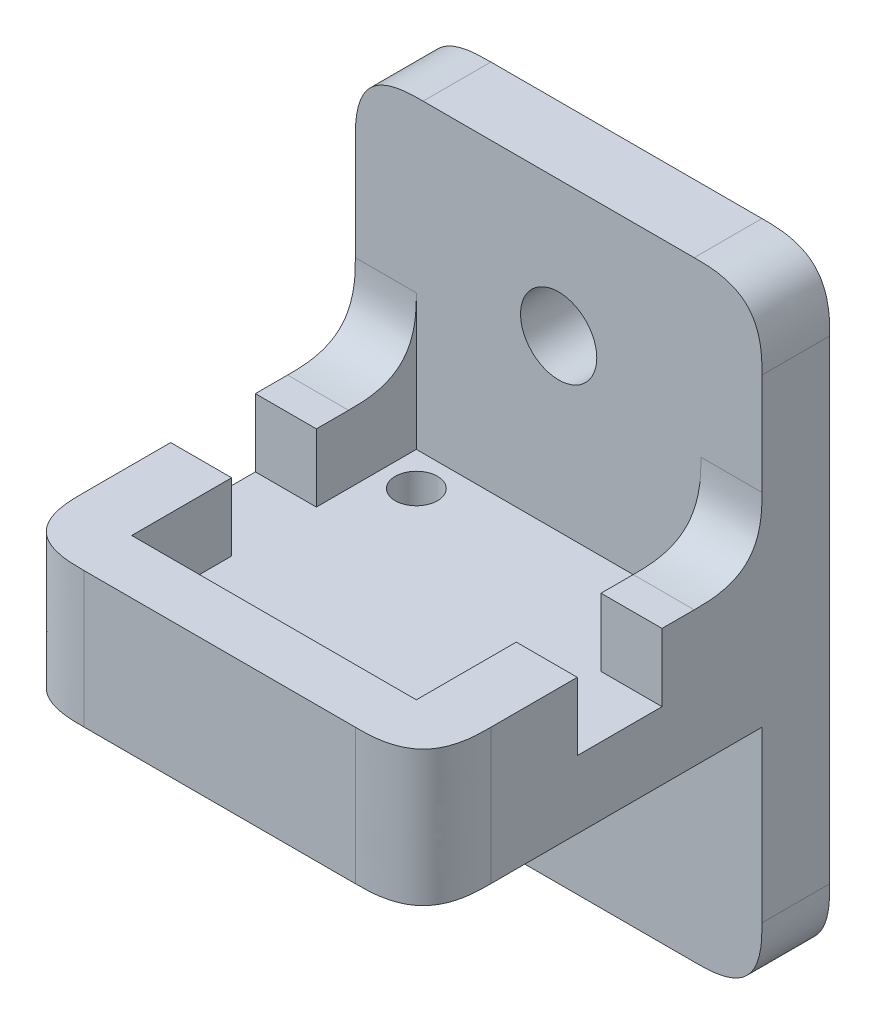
SolidWorks part; units mm, degrees
ref_plane "Front Plane" through (0, 0, 0) normal (0, 0, 1) x (1, 0, 0)
ref_plane "Top Plane" through (0, 0, 0) normal (0, 1, 0) x (1, 0, 0)
ref_plane "Right Plane" through (0, 0, 0) normal (1, 0, 0) x (0, 0, -1)
sketch "Sketch1" plane through (0, 0, 0) normal (0, 0, 1) x (1, 0, 0)
  line L1 (-19.05, -28.575) -> (19.05, -28.575)
  line L2 (-19.05, -28.575) -> (-19.05, 28.575)
  line L3 (-19.05, 28.575) -> (19.05, 28.575)
  line L4 (19.05, -28.575) -> (19.05, 28.575)
  line L5 (-19.05, -28.575) -> (19.05, 28.575) construction
  line L6 (-19.05, 28.575) -> (19.05, -28.575) construction
  circle A0 centre (0, 15.875) radius 3.5719
  circle A1 centre (0, -15.875) radius 3.5719
  point P0 (0, 0)
  dimension "D3" = 7.1437
  dimension "D4" = 12.7
  dimension "D5" = 31.75
  dimension "D6" = 7.1437
  dimension "D1" = 38.1
  dimension "D2" = 12.7
extrude "Boss-Extrude1" add sketch "Sketch1" along normal blind 6.35
sketch "Sketch2" plane through (0, 0, 6.35) normal (0, 0, 1) x (1, 0, 0)
  line L0 (19.05, -28.575) -> (19.05, 28.575) construction
  line L1 (-19.05, -6.35) -> (19.05, -6.35)
  line L2 (-19.05, -6.35) -> (-19.05, 6.35)
  line L3 (-19.05, 6.35) -> (19.05, 6.35)
  line L4 (19.05, -6.35) -> (19.05, 6.35)
  line L5 (-19.05, -6.35) -> (19.05, 6.35) construction
  line L6 (-19.05, 6.35) -> (19.05, -6.35) construction
  point P0 (0, 0)
  dimension "D1" = 12.7
extrude "Boss-Extrude2" add sketch "Sketch2" along normal blind 31.75
sketch "Sketch3" plane through (0, 6.35, 0) normal (0, 1, 0) x (1, 0, 0)
  line L1 (-13.335, -33.02) -> (13.335, -33.02)
  line L2 (-13.335, -33.02) -> (-13.335, -6.35)
  line L3 (-13.335, -6.35) -> (13.335, -6.35)
  line L4 (13.335, -33.02) -> (13.335, -6.35)
  line L5 (-13.335, -33.02) -> (13.335, -6.35) construction
  line L6 (-13.335, -6.35) -> (13.335, -33.02) construction
  line L8 (19.05, -6.35) -> (-19.05, -6.35) construction
  line L9 (19.05, -6.35) -> (-19.05, -6.35)
  point P0 (0, -19.685)
  point P8 (0, -6.35)
  dimension "D1" = 26.67
  dimension "D2" = 26.67
extrude "Cut-Extrude1" cut sketch "Sketch3" against normal blind 6.35 contours L1 L4 L2 M6
sketch "Sketch4" plane through (13.335, 0, 0) normal (-1, 0, 0) x (0, 0, 1)
  line L0 (33.02, 0) -> (6.35, 0) construction
  line L1 (15.7163, 0) -> (23.6538, 0)
  line L2 (15.7163, 0) -> (15.7163, 6.35)
  line L3 (15.7163, 6.35) -> (23.6538, 6.35)
  line L4 (23.6538, 0) -> (23.6538, 6.35)
  line L5 (33.02, 0) -> (6.35, 0)
  line L6 (38.1, 6.35) -> (6.35, 6.35) construction
  point P6 (19.685, 0)
  point P7 (19.685, 6.35)
  dimension "D2" = 7.9375
extrude "Cut-Extrude2" cut sketch "Sketch4" against normal through all both and the other way through all contours L4 L3 L2 M7
sketch "Sketch5" plane through (0, 0, 0) normal (0, 1, 0) x (1, 0, 0)
  line L0 (12.7, -32.385) -> (12.7, -23.0188) construction
  line L1 (12.7, -23.0188) -> (18.415, -23.0188) construction
  line L2 (18.415, -23.0188) -> (18.415, -16.3513) construction
  line L3 (18.415, -16.3513) -> (12.7, -16.3513) construction
  line L4 (12.7, -16.3513) -> (12.7, -6.985) construction
  line L5 (12.7, -6.985) -> (-12.7, -6.985) construction
  line L6 (-12.7, -6.985) -> (-12.7, -16.3513) construction
  line L7 (-12.7, -16.3513) -> (-18.415, -16.3513) construction
  line L8 (-18.415, -16.3513) -> (-18.415, -23.0188) construction
  line L9 (-18.415, -23.0188) -> (-12.7, -23.0188) construction
  line L10 (-12.7, -23.0188) -> (-12.7, -32.385) construction
  line L11 (-12.7, -32.385) -> (12.7, -32.385) construction
  line L12 (13.335, -33.02) -> (13.335, -23.6538)
  line L13 (13.335, -23.6538) -> (19.05, -23.6538)
  line L14 (19.05, -23.6538) -> (19.05, -15.7163)
  line L15 (19.05, -15.7163) -> (13.335, -15.7163)
  line L16 (13.335, -15.7163) -> (13.335, -6.35)
  line L17 (13.335, -6.35) -> (-13.335, -6.35)
  line L18 (-13.335, -6.35) -> (-13.335, -15.7163)
  line L19 (-13.335, -15.7163) -> (-19.05, -15.7163)
  line L20 (-19.05, -15.7163) -> (-19.05, -23.6538)
  line L21 (-19.05, -23.6538) -> (-13.335, -23.6538)
  line L22 (-13.335, -23.6538) -> (-13.335, -33.02)
  line L23 (-13.335, -33.02) -> (13.335, -33.02)
  line L24 (13.335, -33.02) -> (13.335, -23.6538) construction
  line L25 (13.335, -23.6538) -> (19.05, -23.6538) construction
  line L26 (19.05, -23.6538) -> (19.05, -15.7163) construction
  line L27 (19.05, -15.7163) -> (13.335, -15.7163) construction
  line L28 (13.335, -15.7163) -> (13.335, -6.35) construction
  line L29 (13.335, -6.35) -> (-13.335, -6.35) construction
  line L30 (-13.335, -6.35) -> (-13.335, -15.7163) construction
  line L31 (-13.335, -15.7163) -> (-19.05, -15.7163) construction
  line L32 (-19.05, -15.7163) -> (-19.05, -23.6538) construction
  line L33 (-19.05, -23.6538) -> (-13.335, -23.6538) construction
  line L34 (-13.335, -23.6538) -> (-13.335, -33.02) construction
  line L35 (-13.335, -33.02) -> (13.335, -33.02) construction
  circle A0 centre (10.16, -9.525) radius 1.9844
  circle A1 centre (-10.16, -9.525) radius 1.9844
  circle A2 centre (-10.16, -29.845) radius 1.9844
  circle A3 centre (10.16, -29.845) radius 1.9844
  dimension "D3" = 3.9688
  dimension "D4" = 3.9688
  dimension "D5" = 3.9688
  dimension "D6" = 3.9688
  dimension "D10" = 2.54
  dimension "D7" = 2.54
  dimension "D8" = 2.54
  dimension "D9" = 2.54
  dimension "D1" = 0
  dimension "D2" = 0.635
extrude "Cut-Extrude3" cut sketch "Sketch5" against normal through all
fillet "Fillet1" radius 6.35 8 edges at (16.1925, 6.35, 6.35) (-16.1925, 6.35, 6.35) (-19.05, -28.575, 3.175) (19.05, -28.575, 3.175) (19.05, 28.575, 3.175) (-19.05, 28.575, 3.175) (19.05, 0, 38.1) (-19.05, 0, 38.1)
